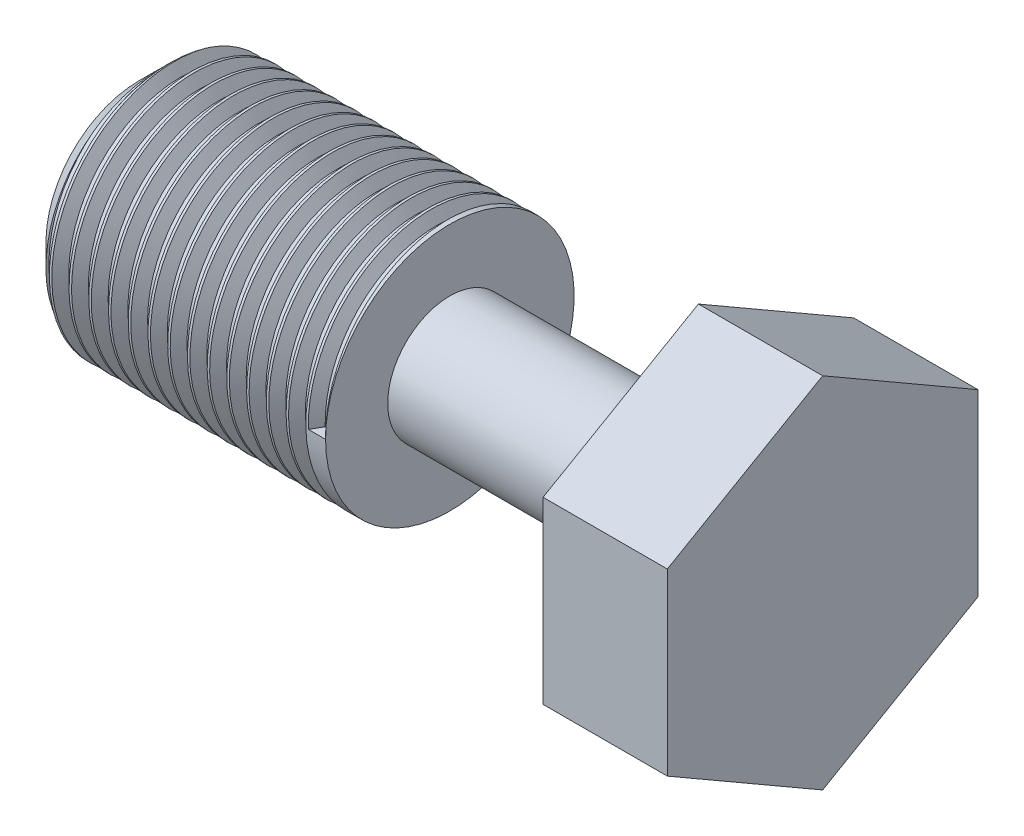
SolidWorks part; units mm, degrees
ref_plane "前视基准面" through (0, 0, 0) normal (0, 0, 1) x (1, 0, 0)
ref_plane "上视基准面" through (0, 0, 0) normal (0, 1, 0) x (1, 0, 0)
ref_plane "右视基准面" through (0, 0, 0) normal (1, 0, 0) x (0, 0, -1)
other "Configuration Table"
sketch "草图1" plane through (0, 0, 0) normal (0, 0, 1) x (1, 0, 0)
  line L0 (0, 0) -> (-12.095, 0) construction
  line L2 (0, 0) -> (-4, 0)
  line L3 (0, 0) -> (0, 1)
  line L4 (0, 1) -> (-4, 1)
  line L5 (-4, 0) -> (-4, 1)
  line L6 (-4, 0) -> (-9, 0)
  line L7 (-4, 0) -> (-4, 2)
  line L8 (-4, 2) -> (-9, 2)
  line L9 (-9, 0) -> (-9, 2)
  dimension "D1" = 5
  dimension "D2" = 4
  dimension "D3" = 1
  dimension "D4" = 2
revolve "旋转1" add sketch "草图1" angle 360 about L6
sketch "草图2" plane through (0, 0, 0) normal (1, 0, 0) x (0, 0, -1)
  line L1 (0, 2.8868) -> (-2.5, 1.4434)
  line L2 (-2.5, 1.4434) -> (-2.5, -1.4434)
  line L3 (-2.5, -1.4434) -> (0, -2.8868)
  line L4 (0, -2.8868) -> (2.5, -1.4434)
  line L5 (2.5, -1.4434) -> (2.5, 1.4434)
  line L6 (2.5, 1.4434) -> (0, 2.8868)
  circle A0 centre (0, 0) radius 2.5 construction
  dimension "D1" = 5
extrude "凸台-拉伸1" add sketch "草图2" along normal blind 2
chamfer "倒角1" distance 0.5 angle 45 1 edges at (-9, 2, 0)
thread "螺纹线1" pitch 0.3175 start angle 0, offset 0, length 5, pitch 0.3175, diameter 4
ref_plane "基准面1" through (-4, 0, 2) normal (0, -1, 0) x (0, 0, 1)
sketch "螺纹线轮廓1" plane through (-4, 0, 2) normal (0, -1, 0) x (0, 0, 1)
  line L0 (0, 0) -> (0, 0.3175) construction
  line L11 (0, 0) -> (0, 0.2778)
  line L12 (0, 0.2778) -> (-0.1719, 0.1786)
  line L13 (-0.1719, 0.1786) -> (-0.1719, 0.0992)
  line L15 (-0.1719, 0.0992) -> (0, 0)
  line L17 (-0.1719, 0.1389) -> (0, 0.1389) construction
  point P2 (0, 0)
  dimension "Pitch" = 0.3175
  dimension "Profile_Angle" = 60
  dimension "Profile_Land" = 0.0794
  dimension "Profile_Height" = 0.1719
